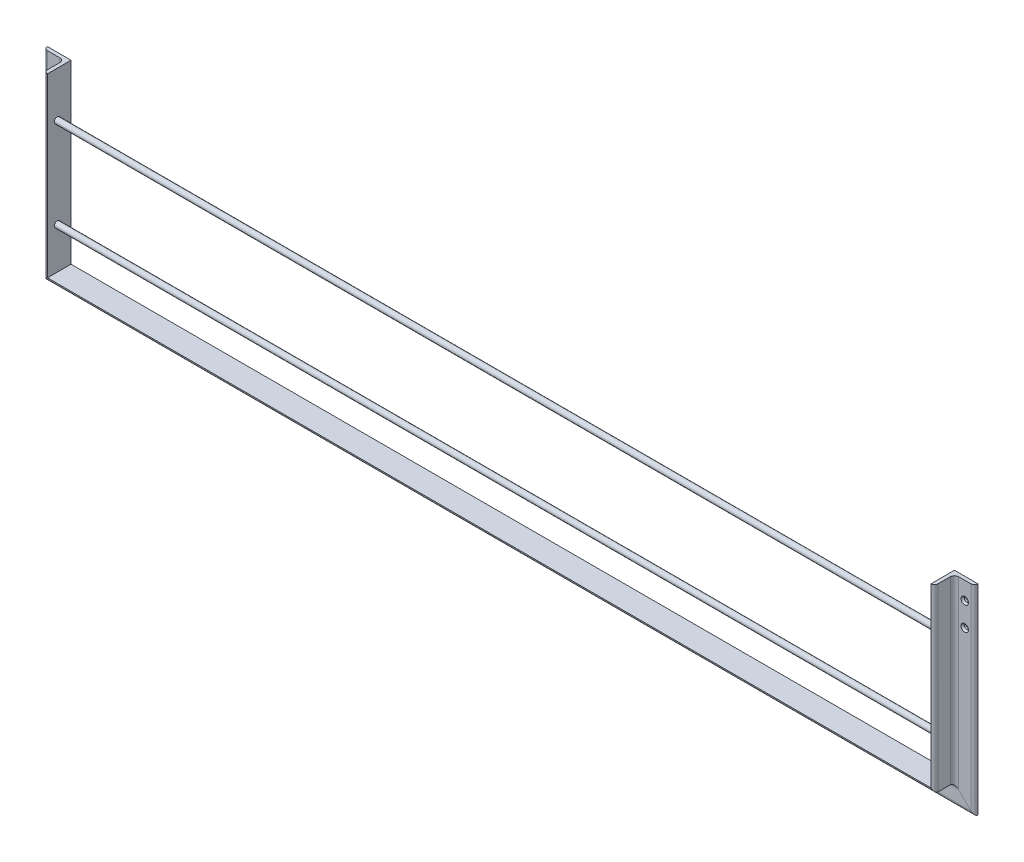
SolidWorks part; units mm, degrees
ref_plane "Front Plane" through (0, 0, 0) normal (0, 0, 1) x (1, 0, 0)
ref_plane "Top Plane" through (0, 0, 0) normal (0, 1, 0) x (1, 0, 0)
ref_plane "Right Plane" through (0, 0, 0) normal (1, 0, 0) x (0, 0, -1)
sketch3d "3DSketch1"
  line L0 (0, 0, 0) -> (750, 0, 0)
  line L1 (750, 0, 0) -> (750, 150, 0)
  line L2 (0, 0, 0) -> (0, 150, 0)
  dimension "D1" = 750
  dimension "D2" = 150
other "Structural Member1"
ref_plane "Plane1" through (0, 0, 0) normal (0, 1, 0) x (-1, 0, 0)
sketch "Sketch1" plane through (0, 0, 0) normal (0, 1, 0) x (-1, 0, 0)
  line L0 (0, 0) -> (0, 20)
  line L1 (0, 10) -> (3, 10) construction
  line L2 (3, 17) -> (3, 6.5)
  line L3 (6.5, 3) -> (17, 3)
  line L4 (10, 3) -> (10, 0) construction
  line L5 (20, 0) -> (0, 0)
  arc A0 (20, 0) -> (17, 3) centre (17, 0) ccw
  arc A1 (0, 20) -> (3, 17) centre (0, 17) cw
  arc A2 (6.5, 3) -> (3, 6.5) centre (6.5, 6.5) cw
  point P10 (10, 0)
  point P14 (0, 10)
  point P15 (3, 10)
  point P16 (10, 3)
  point P17 (3, 20)
  point P18 (20, 3)
  point P21 (0, 0)
  dimension "D2" = 3
  dimension "D3" = 20
  dimension "Radius_1" = 3.5
  dimension "D1" = 3
hole_wizard "CSK for M3 Flat Head Machine Screw1" positions "Sketch4" profile "Sketch3" countersink size "M3" standard "Ansi Metric"
sketch "Sketch4" plane through (0, 0, 3) normal (0, 0, 1) x (1, 0, 0)
  line L0 (-11.75, 150) -> (-11.75, -20) construction
  line L1 (-17, 150) -> (-6.5, 150) construction
  line L2 (761.75, 150) -> (761.75, -20) construction
  line L3 (767, 150) -> (756.5, 150) construction
  line L4 (-20, -20) -> (770, -20) construction
  line L5 (375, -6.5) -> (375, -17) construction
  line L6 (-6.5, -6.5) -> (756.5, -6.5) construction
  line L7 (-17, -17) -> (767, -17) construction
  line L8 (375, -11.75) -> (761.75, -11.75) construction
  line L9 (375, -11.75) -> (-11.75, -11.75) construction
  point P0 (-11.75, 135)
  point P1 (-11.75, 115)
  point P2 (761.75, 135)
  point P3 (761.75, 115)
  point P23 (568.375, -11.75)
  point P24 (181.625, -11.75)
  dimension "D2" = 15
  dimension "D3" = 20
sketch "Sketch3" plane through (-11.75, 135, 3) normal (1, 0, 0) x (0, -1, 0)
  line L0 (0, 0) -> (0, 3)
  line L1 (0, 3) -> (1.7, 3)
  line L2 (1.7, 3) -> (1.7, 1.45)
  line L3 (1.7, 1.45) -> (3.15, 0)
  line L5 (3.15, 0) -> (0, 0)
  line L6 (-1.7, 1.45) -> (-3.15, 0) construction
  line L11 (0, -6.35) -> (0, 107.95) construction
  dimension "Thru Hole Dia." = 3.4
  dimension "Thru Hole Depth" = 3
  dimension "Near C'Sink Dia." = 6.3
  dimension "Near C'Sink Angle" = 90
sketch "Sketch7" plane through (0, 0, 0) normal (1, 0, 0) x (0, 0, -1)
  line L0 (-11.75, 73.5) -> (-11.75, 150) construction
  line L3 (-17, 73.5) -> (-6.5, 73.5) construction
  line L4 (-17, -3) -> (-17, 150) construction
  line L5 (-6.5, -3) -> (-6.5, 150) construction
  line L6 (-6.5, 150) -> (-17, 150) construction
  line L7 (-11.75, 73.5) -> (-11.75, -3) construction
  line L8 (-6.5, -3) -> (-17, -3) construction
  circle A0 centre (-11.75, 111.75) radius 2.5
  circle A1 centre (-11.75, 35.25) radius 2.5
  point P4 (-11.75, 111.75)
  point P14 (-11.75, 35.25)
  dimension "D1" = 5
extrude "Extrude1" add sketch "Sketch7" along normal up to next separate body
